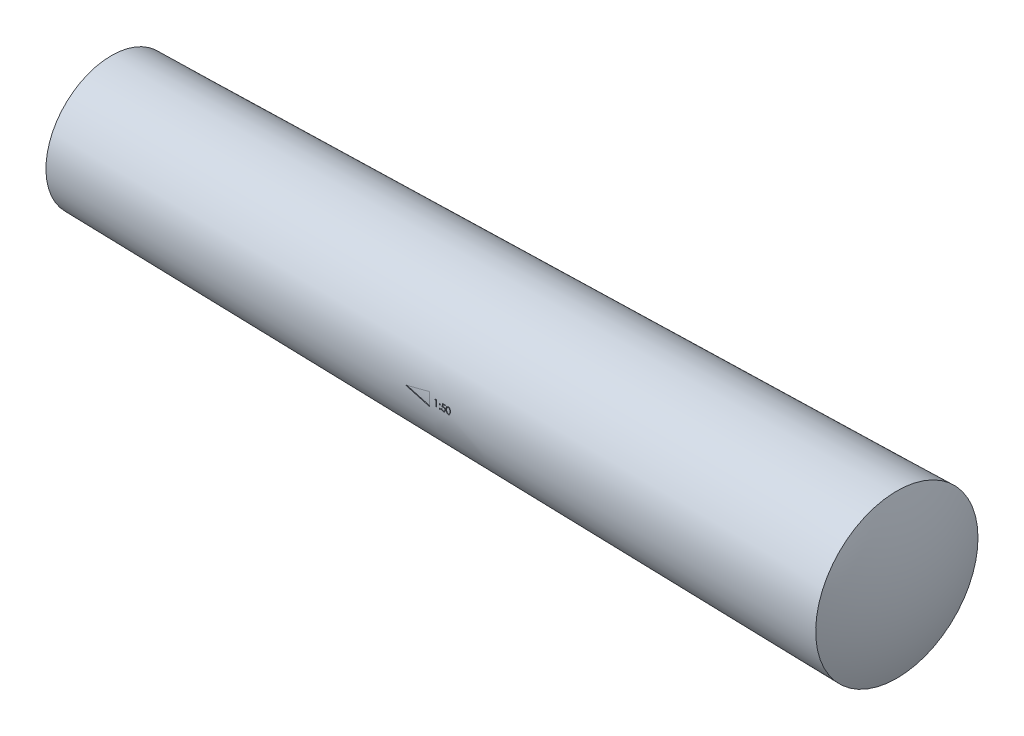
SolidWorks part; units mm, degrees
ref_plane "Front Plane" through (0, 0, 0) normal (0, 0, 1) x (1, 0, 0)
ref_plane "Top Plane" through (0, 0, 0) normal (0, 1, 0) x (1, 0, 0)
ref_plane "Right Plane" through (0, 0, 0) normal (1, 0, 0) x (0, 0, -1)
sketch "Sketch1" plane through (0, 0, 0) normal (1, 0, 0) x (0, 0, -1)
  circle A0 centre (0, 0) radius 10
  dimension "D1" = 20
extrude "Extrude1" add sketch "Sketch1" along normal mid plane 120
draft "Draft1" type of draft neutral plane draft angle 1.146 faces to draft 1 parameters "D1"=1.146
sketch "Sketch2" plane through (0, 0, 0) normal (0, 0, 1) x (1, 0, 0)
  line L0 (-60, 0) -> (-60, 10)
  line L1 (-60, 10) -> (-60, -10) construction
  line L2 (-60, 0) -> (-62.5, 0)
  line L3 (-62.5, 0) -> (-62.5, -11.2) construction
  line L4 (60, 0) -> (60, 12.4001)
  line L5 (60, -12.4001) -> (60, 12.4001) construction
  line L6 (60, 0) -> (62.5, 0)
  line L7 (62.5, 0) -> (62.5, -11.2) construction
  line L8 (-60, -10) -> (60, -12.4001) construction
  arc A0 (-62.5, 0) -> (-60, 10) centre (-41.25, 0) cw
  arc A1 (62.5, 0) -> (60, 12.4001) centre (30.4976, 0) ccw
  point P14 (0, -11.2)
revolve "Revolve1" add sketch "Sketch2" angle 360 about L2
sketch "Sketch5" plane through (0, 0, 0) normal (0, 0, 1) x (1, 0, 0)
  line L0 (0, 11.2) -> (0, -11.2) construction
  line L1 (60, 12.4001) -> (-60, 10) construction
  line L2 (-60, -10) -> (60, -12.4001) construction
ref_plane "Plane2" through (0, 0, 0) normal (-0.02, 0, 0.9998) x (0.9998, 0, 0.02)
sketch "Sketch6" plane through (0, 0, 0) normal (-0.02, 0, 0.9998) x (0.9998, 0, 0.02)
  line L0 (0, 0) -> (0, 1)
  line L1 (0, 11.2) -> (0, -11.2) construction
  line L2 (0, 1) -> (-3.7321, 0)
  line L3 (-3.7321, 0) -> (0, -1)
  line L4 (0, -1) -> (0, 0)
  line L5 (0, -0.5) -> (4, -0.5) construction
  text T0 "1:50" font "Century Gothic" height 1
  dimension "D1" = 2
  dimension "D2" = 30
  dimension "D3" = 4
wrap "Wrap2" sketch "Sketch6" wrap type deboss source sketch "Sketch6" thickness 0.1 parameters "D1"=0.1
equation "\"D2@Sketch2\" = \"D1@Sketch2\""
